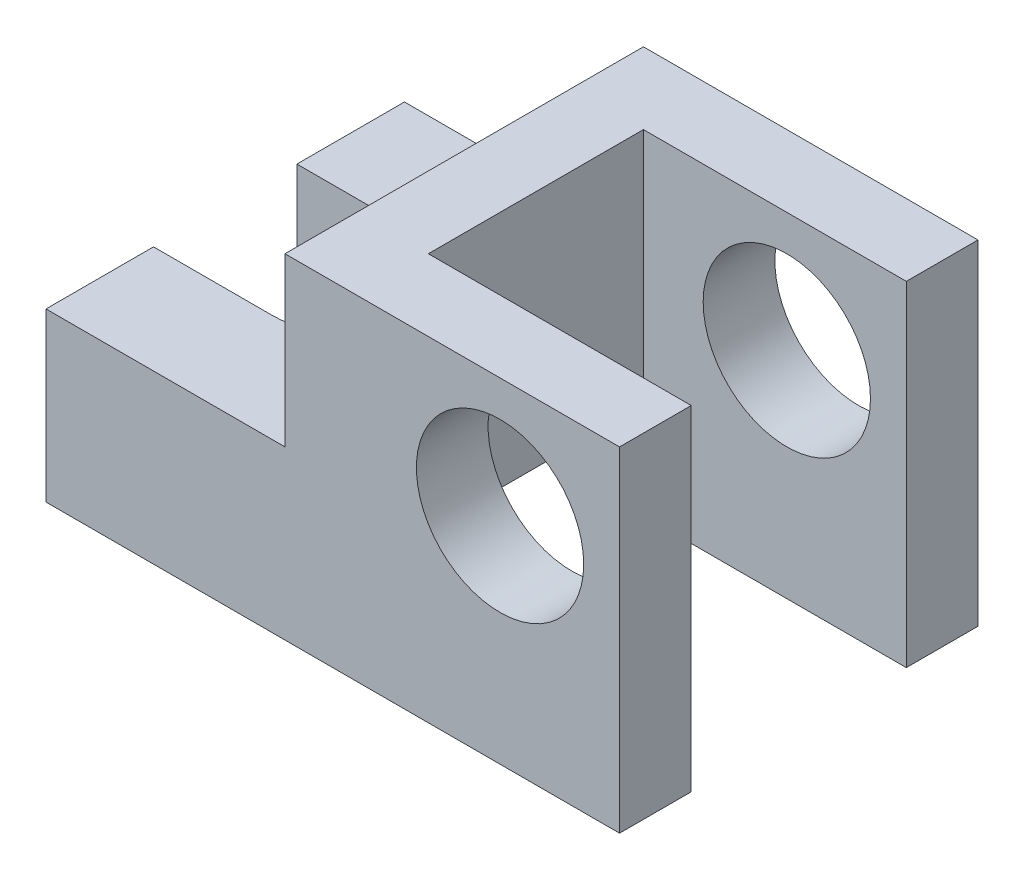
SolidWorks part; units mm, degrees
ref_plane "前视基准面" through (0, 0, 0) normal (0, 0, 1) x (1, 0, 0)
ref_plane "上视基准面" through (0, 0, 0) normal (0, 1, 0) x (1, 0, 0)
ref_plane "右视基准面" through (0, 0, 0) normal (1, 0, 0) x (0, 0, -1)
sketch "草图1" plane through (0, 0, 0) normal (0, 1, 0) x (1, 0, 0)
  line L1 (0, 0) -> (48, 0)
  line L2 (0, 0) -> (0, 30)
  line L3 (0, 30) -> (48, 30)
  line L4 (48, 0) -> (48, 30)
  dimension "D1" = 48
  dimension "D2" = 30
extrude "拉伸1" add sketch "草图1" along normal blind 14
sketch "草图2" plane through (0, 14, 0) normal (0, 1, 0) x (1, 0, 0)
  line L0 (0, 15) -> (10, 15) construction
  line L1 (0, 30) -> (0, 0) construction
  line L2 (0, 9) -> (10, 9)
  line L3 (0, 21) -> (10, 21)
  arc A0 (0, 9) -> (0, 21) centre (0, 15) cw
  arc A1 (10, 9) -> (10, 21) centre (10, 15) ccw
  dimension "D1" = 10
  dimension "D2" = 6
  dimension "D3" = 6
extrude "切除-拉伸1" cut sketch "草图2" against normal through all
sketch "草图3" plane through (0, 0, 0) normal (-1, 0, 0) x (0, 0, 1)
  line L0 (-15, 14) -> (-15, 18.3506) construction
  line L1 (-9, 14) -> (-21, 14) construction
  line L2 (-30, 0) -> (-21, 0) construction
  line L3 (-24, 0) -> (-6, 0)
  line L4 (-24, 0) -> (-24, 8)
  line L5 (-24, 8) -> (-6, 8)
  line L6 (-6, 0) -> (-6, 8)
  dimension "D1" = 18
  dimension "D2" = 8
extrude "切除-拉伸2" cut sketch "草图3" against normal through all
sketch "草图4" plane through (0, 14, 0) normal (0, 1, 0) x (1, 0, 0)
  line L0 (48, 30) -> (0, 30) construction
  line L1 (48, 0) -> (20, 0)
  line L2 (48, 0) -> (48, 30)
  line L3 (48, 30) -> (20, 30)
  line L4 (20, 0) -> (20, 30)
  line L5 (0, 30) -> (0, 21) construction
  point P7 (0, 25.5)
  dimension "D1" = 20
extrude "拉伸2" add sketch "草图4" along normal offset from surface (14 mm away) 28
sketch "草图5" plane through (0, 28, 0) normal (0, 1, 0) x (1, 0, 0)
  line L0 (48, 15) -> (28.6743, 15) construction
  line L1 (48, 30) -> (48, 0) construction
  line L3 (48, 24) -> (26, 24)
  line L4 (48, 24) -> (48, 6)
  line L5 (48, 6) -> (26, 6)
  line L6 (26, 24) -> (26, 6)
  dimension "D1" = 22
  dimension "D2" = 18
extrude "切除-拉伸3" cut sketch "草图5" against normal through all
sketch "草图6" plane through (0, 0, 0) normal (0, 0, 1) x (1, 0, 0)
  line L0 (48, 28) -> (48, 0) construction
  line L1 (0, 0) -> (48, 0) construction
  circle A0 centre (38, 18) radius 7
  dimension "D3" = 14
  dimension "D1" = 10
  dimension "D2" = 18
extrude "切除-拉伸4" cut sketch "草图6" against normal through all
